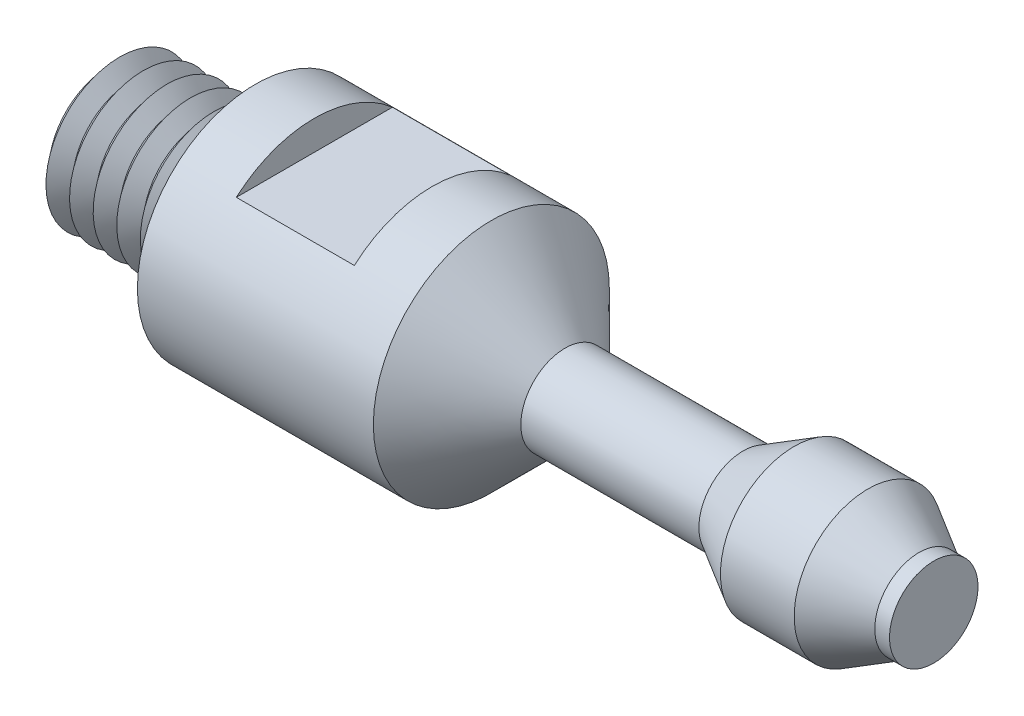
SolidWorks part; units mm, degrees
ref_plane "Front Plane" through (0, 0, 0) normal (0, 0, 1) x (1, 0, 0)
ref_plane "Top Plane" through (0, 0, 0) normal (0, 1, 0) x (1, 0, 0)
ref_plane "Right Plane" through (0, 0, 0) normal (1, 0, 0) x (0, 0, -1)
sketch "Sketch1" plane through (0, 0, 0) normal (0, 0, 1) x (1, 0, 0)
  line L0 (0, 0) -> (-72.7503, 0) construction
  line L1 (0, 0) -> (0, 1.5)
  line L2 (0, 1.5) -> (-0.5, 1.5)
  line L3 (-0.5, 1.5) -> (-2.2321, 2.5)
  line L4 (-2.2321, 2.5) -> (-4.7321, 2.5)
  line L5 (-4.7321, 2.5) -> (-6.4641, 1.5)
  line L6 (-6.4641, 1.5) -> (-12.5, 1.5)
  line L7 (-12.5, 1.5) -> (-15, 4)
  line L8 (-15, 4) -> (-23, 4)
  line L9 (-23, 4) -> (-23, 1.8)
  line L10 (-23, 1.8) -> (-24, 1.8)
  line L11 (-24, 1.8) -> (-24, 2.5)
  line L12 (-24, 2.5) -> (-28, 2.5)
  line L14 (-28, 2.5) -> (-28, 0)
  line L15 (-28, 0) -> (0, 0)
  dimension "D1" = 5
  dimension "D2" = 23
  dimension "D3" = 8
  dimension "D4" = 5
  dimension "D5" = 1
  dimension "D6" = 0.7
  dimension "D7" = 3
  dimension "D8" = 150
  dimension "D9" = 150
  dimension "D10" = 45
  dimension "D11" = 5
  dimension "D12" = 0.5
  dimension "D13" = 2.5
  dimension "D14" = 8
revolve "Revolve1" add sketch "Sketch1" angle 360 about L0
sketch "Sketch3" plane through (0, 0, 0) normal (0, 0, 1) x (1, 0, 0)
  line L0 (0, 0) -> (-29.3719, 0) construction
  line L1 (-21, -4.5) -> (-17, -4.5)
  line L2 (-21, -4.5) -> (-21, -3)
  line L3 (-21, -3) -> (-17, -3)
  line L4 (-17, -4.5) -> (-17, -3)
  line L5 (-21, 3) -> (-17, 3)
  line L6 (-17, 4.5) -> (-17, 3)
  line L7 (-21, 4.5) -> (-21, 3)
  line L8 (-21, 4.5) -> (-17, 4.5)
  line L9 (-23, -4) -> (-15, -4) construction
  line L10 (-23, 4) -> (-23, -4) construction
  dimension "D1" = 4
  dimension "D2" = 6
  dimension "D3" = 0.5
  dimension "D4" = 2
extrude "Extrude1" cut sketch "Sketch3" against normal through all and the other way through all
sketch "Sketch2" plane through (0, 0, 0) normal (0, 0, 1) x (1, 0, 0)
  line L0 (0, 0) -> (-33.3773, 0) construction
  line L1 (-27.6, 2.5) -> (-28.4, 2.5)
  line L2 (-24, 2.5) -> (-28, 2.5) construction
  line L3 (-28.4, 2.5) -> (-28, 2.0004)
  line L4 (-28, 2.5) -> (-28, -2.5) construction
  line L5 (-28, 2.0004) -> (-27.6, 2.5)
revolve "Cut-Revolve1" cut sketch "Sketch2" angle 360 about L0
pattern_linear "LPattern1" count 6 spacing 0.8 along (1, 0, 0) of "Cut-Revolve1"
equation "\"D2@Sketch2\"=\"D1@Sketch2\"*0.8"
